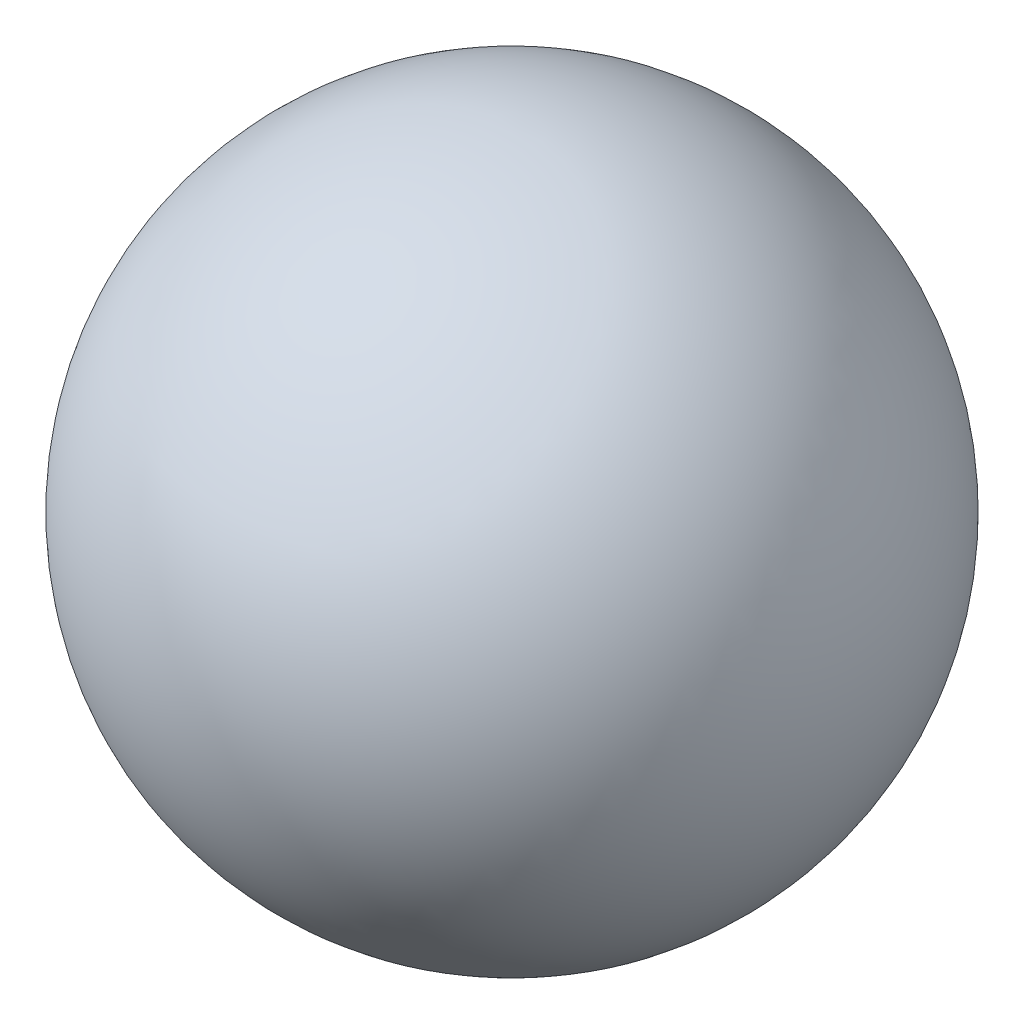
SolidWorks part; units mm, degrees
ref_plane "Vorne XY" through (0, 0, 0) normal (0, 0, 1) x (1, 0, 0)
ref_plane "Oben XZ" through (0, 0, 0) normal (0, 1, 0) x (1, 0, 0)
ref_plane "Seite YZ" through (0, 0, 0) normal (1, 0, 0) x (0, 0, -1)
sketch "Skizze1" plane through (0, 0, 0) normal (0, 0, 1) x (1, 0, 0)
  line L0 (0, -60) -> (0, 60)
  arc A0 (0, 60) -> (0, -60) centre (0, 0) ccw
  dimension "D1" = 120
revolve "Rotation1" add sketch "Skizze1" angle 360 about L0
